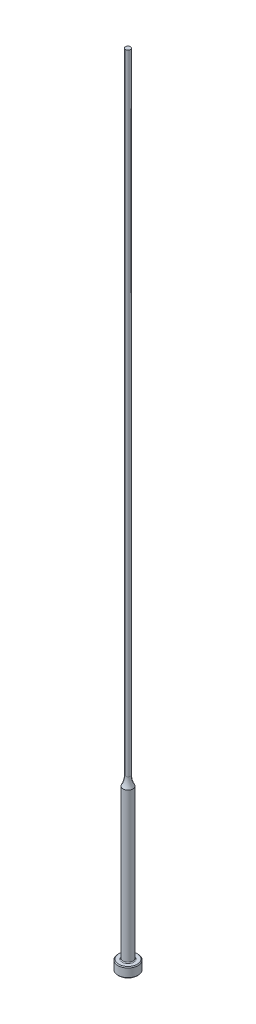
SolidWorks part; units mm, degrees
ref_plane "Front Plane" through (0, 0, 0) normal (0, 0, 1) x (1, 0, 0)
ref_plane "Top Plane" through (0, 0, 0) normal (0, 1, 0) x (1, 0, 0)
ref_plane "Right Plane" through (0, 0, 0) normal (1, 0, 0) x (0, 0, -1)
sketch "Sketch1" plane through (0, 0, 0) normal (0, 0, 1) x (1, 0, 0)
  line L0 (0, 259.9588) -> (0, -15.1925) construction
  line L1 (0, 0) -> (-3.175, 0)
  line L2 (-3.175, 0) -> (-3.175, 3.175)
  line L3 (-3.175, 3.175) -> (-1.5875, 3.175)
  line L4 (-0.7937, 53.8742) -> (-0.7937, 254)
  line L5 (-0.7937, 254) -> (0, 254)
  line L6 (0, 254) -> (0, 0)
  line L7 (-1.5875, 3.175) -> (-1.5875, 50.8)
  arc A0 (-1.5875, 50.8) -> (-0.7937, 53.8742) centre (-7.1437, 53.8742) ccw
  point P13 (-1.5875, 0)
  dimension "D1" = 6.35
  dimension "L" = 254
  dimension "D2" = 3.175
  dimension "H" = 6.35
  dimension "T" = 3.175
  dimension "D" = 1.5875
  dimension "S" = 50.8
revolve "Revolve1" add sketch "Sketch1" angle 360 about L0
chamfer "Chamfer1" distance 0.254 angle 45 2 edges at (0, 3.175, 3.175) (0, 0, 3.175)
fillet "Fillet1" radius 0.254 1 edges at (0, 3.175, 1.5875)
